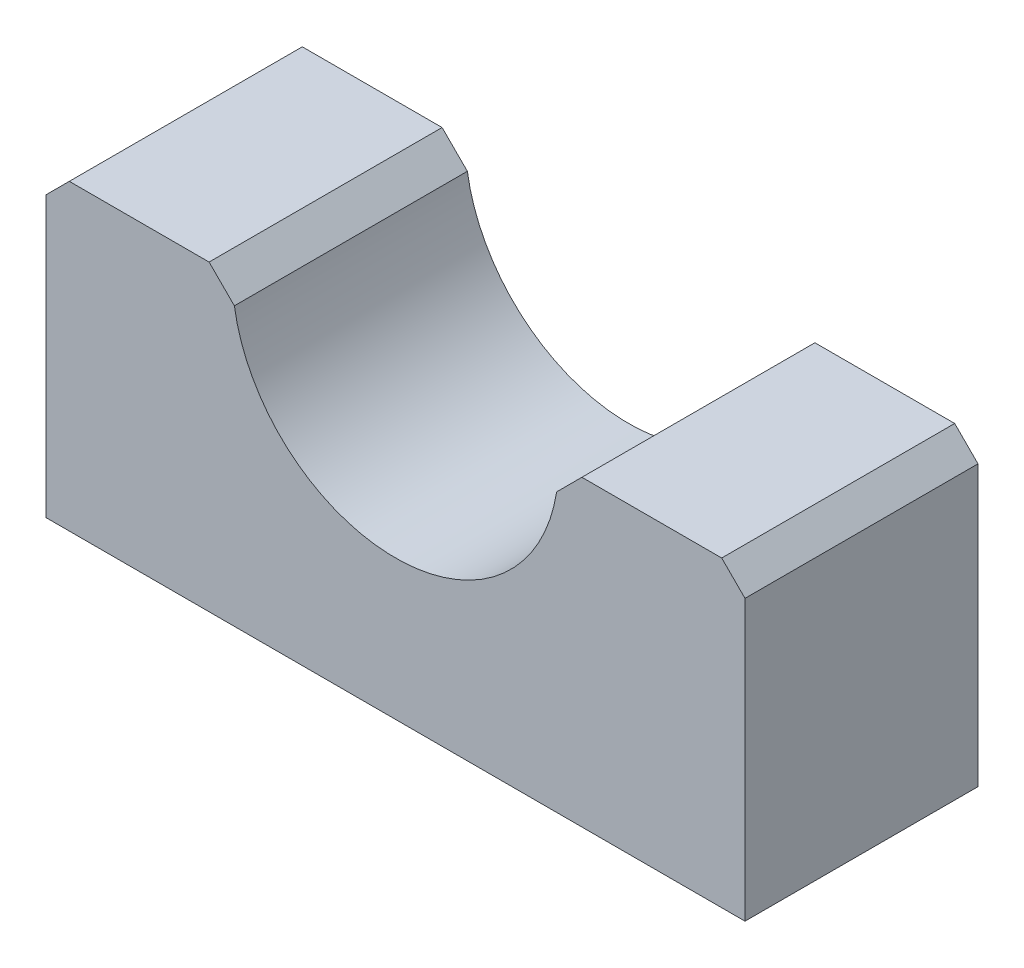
SolidWorks part; units mm, degrees
ref_plane "Front Plane" through (0, 0, 0) normal (0, 0, 1) x (1, 0, 0)
ref_plane "Top Plane" through (0, 0, 0) normal (0, 1, 0) x (1, 0, 0)
ref_plane "Right Plane" through (0, 0, 0) normal (1, 0, 0) x (0, 0, -1)
sketch "Sketch2" plane through (0, 0, 0) normal (0, 0, 1) x (1, 0, 0)
  line L0 (0, 0) -> (0, -65) construction
  line L10 (75, 0) -> (35, 0)
  line L11 (-35, 0) -> (-75, 0)
  line L12 (-75, 0) -> (-75, -65)
  line L13 (-75, -65) -> (75, -65)
  line L14 (75, -65) -> (75, 0)
  arc A2 (-35, 0) -> (35, 0) centre (0, 0) ccw
  dimension "D3" = 35
  dimension "D1" = 150
  dimension "D2" = 65
extrude "Boss-Extrude1" add sketch "Sketch2" along normal blind 50
chamfer "Chamfer1" distance 5 angle 45 4 edges at (75, 0, 25) (35, 0, 25) (-35, 0, 25) (-75, 0, 25)
